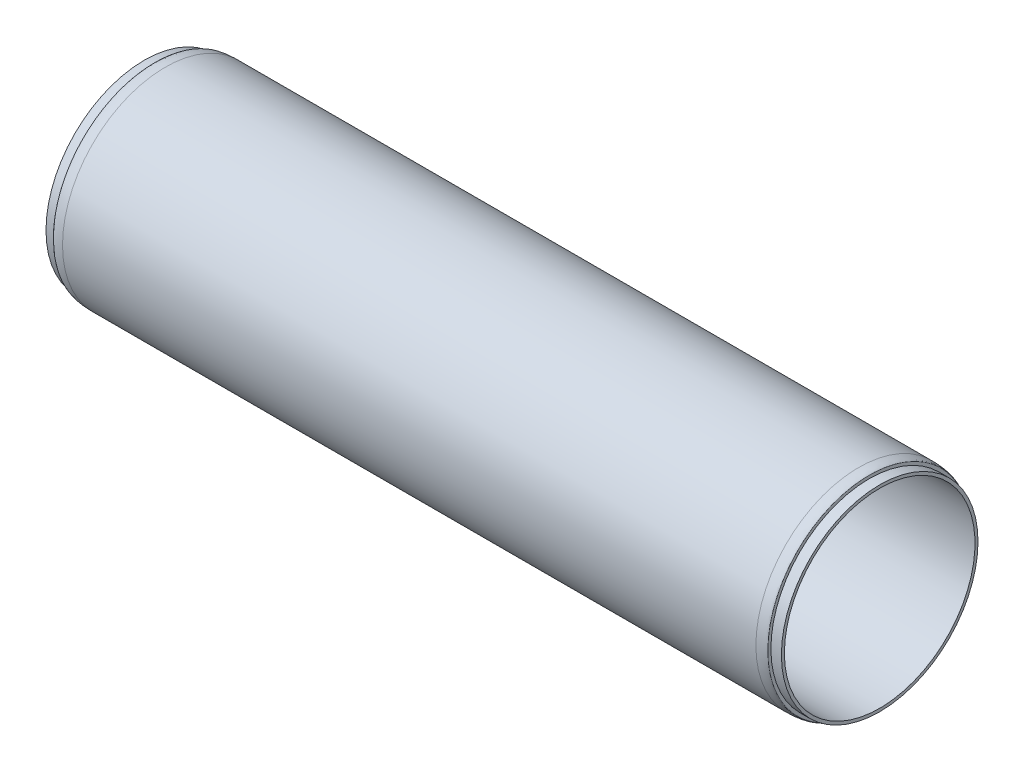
SolidWorks part; units mm, degrees
ref_plane "Front" through (0, 0, 0) normal (0, 0, 1) x (1, 0, 0)
ref_plane "Top" through (0, 0, 0) normal (0, 1, 0) x (1, 0, 0)
ref_plane "Right" through (0, 0, 0) normal (1, 0, 0) x (0, 0, -1)
sketch "Sketch1" plane through (0, 0, 0) normal (1, 0, 0) x (0, 0, -1)
  circle A0 centre (0, 0) radius 8.6995
  dimension "D1" = 17.399
extrude "Extrude-Thin1" add sketch "Sketch1" along normal blind 62.23 thin
sketch "Sketch2" plane through (0, 0, 0) normal (0, 0, 1) x (1, 0, 0)
  line L0 (62.23, 8.6995) -> (0, 8.6995) construction
  line L1 (0, 8.6995) -> (1.778, 8.6995)
  line L2 (0, 8.6995) -> (0, 8.3185)
  line L3 (0, 8.3185) -> (0.889, 8.3185)
  line L4 (0.889, 8.5725) -> (0.889, 8.3185)
  line L9 (0, 8.6995) -> (0, -8.6995) construction
  ellipse E0 centre (1.778, 8.5725) end of major axis (0.889, 8.5725) minor radius 0.127 (1.778, 8.6995) -> (0.889, 8.5725) ccw
  dimension "D3" = 0.889
  dimension "D4" = 0.381
  dimension "D5" = 0.127
  dimension "D6" = 1.778
revolve "Cut-Revolve1" cut sketch "Sketch2" angle 360 about axis through (62.23, 0, 0) along (-1, 0, 0)
ref_plane "Plane1" through (31.115, 0, 0) normal (1, 0, 0) x (0, 0, -1)
mirror "Mirror1" about plane through (31.115, 0, 0) normal (1, 0, 0) of "Cut-Revolve1"
